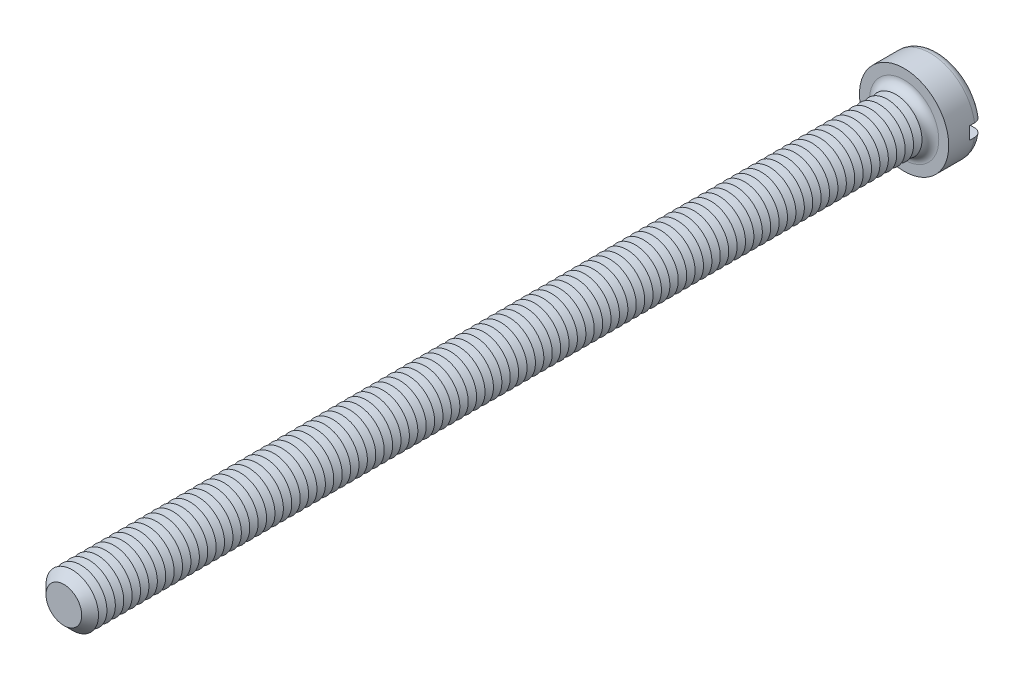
SolidWorks part; units mm, degrees
ref_plane "Front Plane" through (0, 0, 0) normal (0, 0, 1) x (1, 0, 0)
ref_plane "Top Plane" through (0, 0, 0) normal (0, 1, 0) x (1, 0, 0)
ref_plane "Right Plane" through (0, 0, 0) normal (1, 0, 0) x (0, 0, -1)
sketch "Sketch3" plane through (0, 0, 0) normal (0, 0, 1) x (1, 0, 0)
  circle A0 centre (0, 0) radius 4.25
  dimension "D1" = 8.5
extrude "Boss-Extrude2" add sketch "Sketch3" against normal blind 3.3
sketch "Sketch4" plane through (0, 0, 0) normal (0, 0, 1) x (1, 0, 0)
  circle A0 centre (0, 0) radius 2.5
  dimension "D1" = 5
extrude "Boss-Extrude3" add sketch "Sketch4" along normal blind 80
fillet "Fillet1" radius 0.8 2 edges at (4.25, 0, -3.3) (2.5, 0, 0)
chamfer "Chamfer1" distance 0.8 angle 45 1 edges at (2.5, 0, 80)
sketch "Sketch5" plane through (0, 0, 0) normal (1, 0, 0) x (0, 0, -1)
  line L0 (1.6944, 0) -> (-7.6738, 0) construction
sketch "Sketch6" plane through (0, 0, 0) normal (1, 0, 0) x (0, 0, -1)
  line L0 (-0.8, 2.5) -> (-1.2, 1.8072)
  line L1 (-1.2, 1.8072) -> (-1.6, 2.5)
  line L2 (-0.8, 2.5) -> (-79.2, 2.5) construction
  line L3 (-1.6, 2.5) -> (-0.8, 2.5)
  dimension "D1" = 0.8
revolve "Cut-Revolve1" cut sketch "Sketch6" angle 360 about L0
pattern_linear "LPattern1" count 98 spacing 0.8 along (0, 0, 1) of "Cut-Revolve1"
sketch "Sketch8" plane through (0, 0, -3.3) normal (0, 0, -1) x (-1, 0, 0)
  line L1 (4.25, -0.6) -> (-4.25, -0.6)
  line L2 (4.25, -0.6) -> (4.25, 0.6)
  line L3 (4.25, 0.6) -> (-4.25, 0.6)
  line L4 (-4.25, -0.6) -> (-4.25, 0.6)
  line L5 (4.25, -0.6) -> (-4.25, 0.6) construction
  line L6 (4.25, 0.6) -> (-4.25, -0.6) construction
  point P0 (0, 0)
  dimension "D1" = 8.5
  dimension "D2" = 1.2
extrude "Cut-Extrude1" cut sketch "Sketch8" against normal blind 1.3
